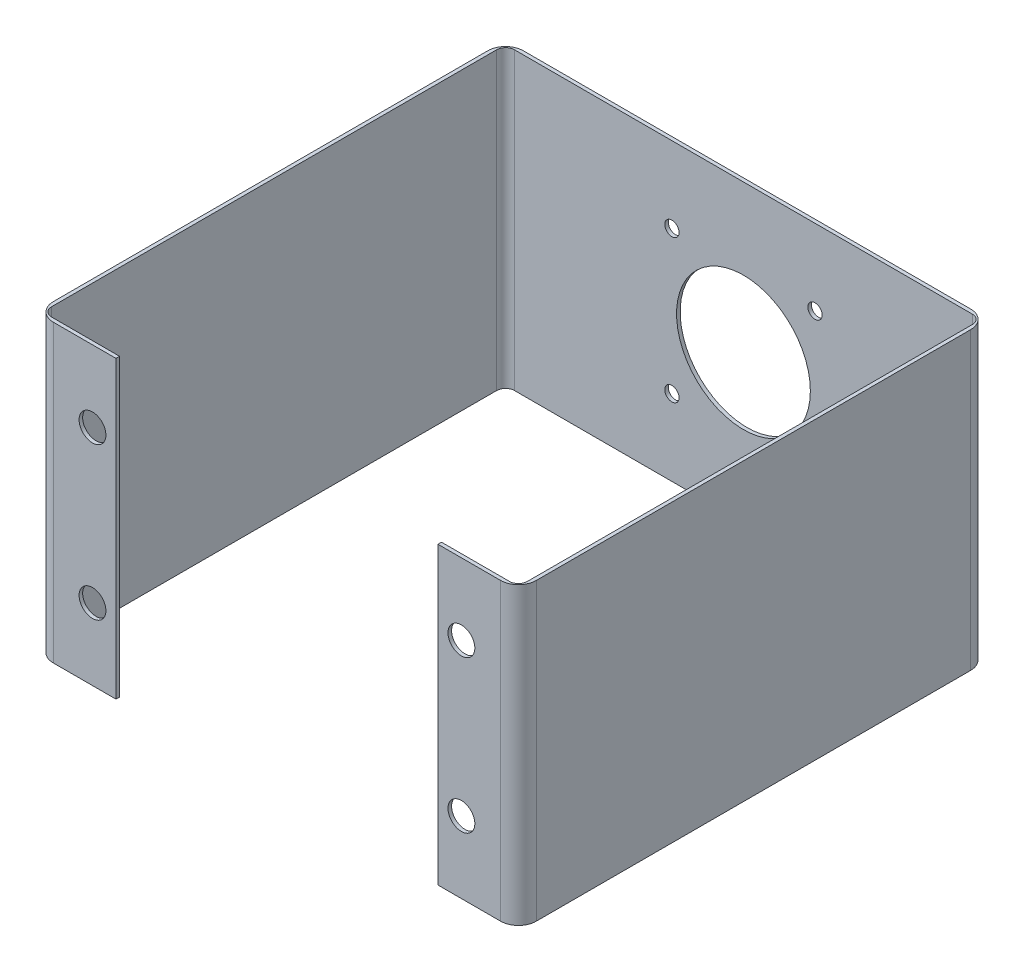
SolidWorks part; units mm, degrees
ref_plane "Front" through (0, 0, 0) normal (0, 0, 1) x (1, 0, 0)
ref_plane "Top" through (0, 0, 0) normal (0, 1, 0) x (1, 0, 0)
ref_plane "Right" through (0, 0, 0) normal (1, 0, 0) x (0, 0, -1)
sketch "Sketch1" plane through (0, 0, 0) normal (0, 1, 0) x (1, 0, 0)
  line L0 (-85.725, 83.439) -> (85.725, -83.439) construction
  line L1 (-85.725, 83.439) -> (85.725, 83.439)
  line L2 (-85.725, 83.439) -> (-85.725, -83.439)
  line L3 (-85.725, -83.439) -> (85.725, -83.439)
  line L4 (85.725, 83.439) -> (85.725, -83.439)
  line L5 (-84.455, 82.169) -> (84.455, 82.169)
  line L6 (84.455, 82.169) -> (84.455, -82.169)
  line L7 (-84.455, -82.169) -> (84.455, -82.169)
  line L8 (-84.455, 82.169) -> (-84.455, -82.169)
  dimension "D1" = 166.878
  dimension "D2" = 171.45
  dimension "D3" = 1.27
extrude "BODY" add sketch "Sketch1" along normal blind 52.3875 and the other way blind 52.3875
sketch "Sketch2" plane through (0, 52.3875, 0) normal (0, 1, 0) x (-1, 0, 0)
  line L0 (0, 0) -> (0, 56.1452) construction
  line L2 (57.15, 56.1452) -> (-57.15, 56.1452)
  line L3 (57.15, 56.1452) -> (57.15, 92.6494)
  line L4 (57.15, 92.6494) -> (-57.15, 92.6494)
  line L5 (-57.15, 56.1452) -> (-57.15, 92.6494)
  dimension "D1" = 114.3
extrude "ENDS" cut sketch "Sketch2" against normal through all
fillet "R1" radius 3.175 4 edges at (-84.455, 0, 82.169) (84.455, 0, 82.169) (84.455, 0, -82.169) (-84.455, 0, -82.169)
fillet "R2" radius 6.35 4 edges at (85.725, 0, -83.439) (85.725, 0, 83.439) (-85.725, 0, 83.439) (-85.725, 0, -83.439)
sketch "Sketch3" plane through (0, 0, 83.439) normal (0, 0, 1) x (1, 0, 0)
  line L0 (-65.4812, 26.9875) -> (65.4812, -26.9875) construction
  line L1 (-65.4812, 26.9875) -> (65.4812, 26.9875) construction
  line L2 (-65.4812, 26.9875) -> (-65.4812, -26.9875) construction
  line L3 (-65.4812, -26.9875) -> (65.4812, -26.9875) construction
  line L4 (65.4812, 26.9875) -> (65.4812, -26.9875) construction
  circle A0 centre (-65.4812, 26.9875) radius 4.7625
  circle A1 centre (65.4812, 26.9875) radius 4.7625
  circle A2 centre (-65.4812, -26.9875) radius 4.7625
  circle A4 centre (65.4812, -26.9875) radius 4.7625
  dimension "D3" = 9.525
  dimension "D1" = 130.9624
  dimension "D2" = 53.975
extrude "HOLES" cut sketch "Sketch3" against normal up to next
sketch "Sketch4" plane through (0, 0, -82.169) normal (0, 0, 1) x (1, 0, 0)
  circle A0 centre (0, 0) radius 23.749
  dimension "D1" = 47.498
extrude "DIA" cut sketch "Sketch4" against normal up to next
sketch "Sketch5" plane through (0, 0, -82.169) normal (0, 0, 1) x (1, 0, 0)
  line L0 (-25.4, 25.4) -> (25.4, -25.4) construction
  line L1 (-25.4, 25.4) -> (25.4, 25.4) construction
  line L2 (-25.4, 25.4) -> (-25.4, -25.4) construction
  line L3 (-25.4, -25.4) -> (25.4, -25.4) construction
  line L4 (25.4, 25.4) -> (25.4, -25.4) construction
  circle A0 centre (-25.4, 25.4) radius 2.54
  circle A1 centre (25.4, 25.4) radius 2.54
  circle A2 centre (25.4, -25.4) radius 2.54
  circle A3 centre (-25.4, -25.4) radius 2.54
  dimension "D2" = 5.08
  dimension "D1" = 50.8
extrude "HOLES2" cut sketch "Sketch5" against normal up to next
